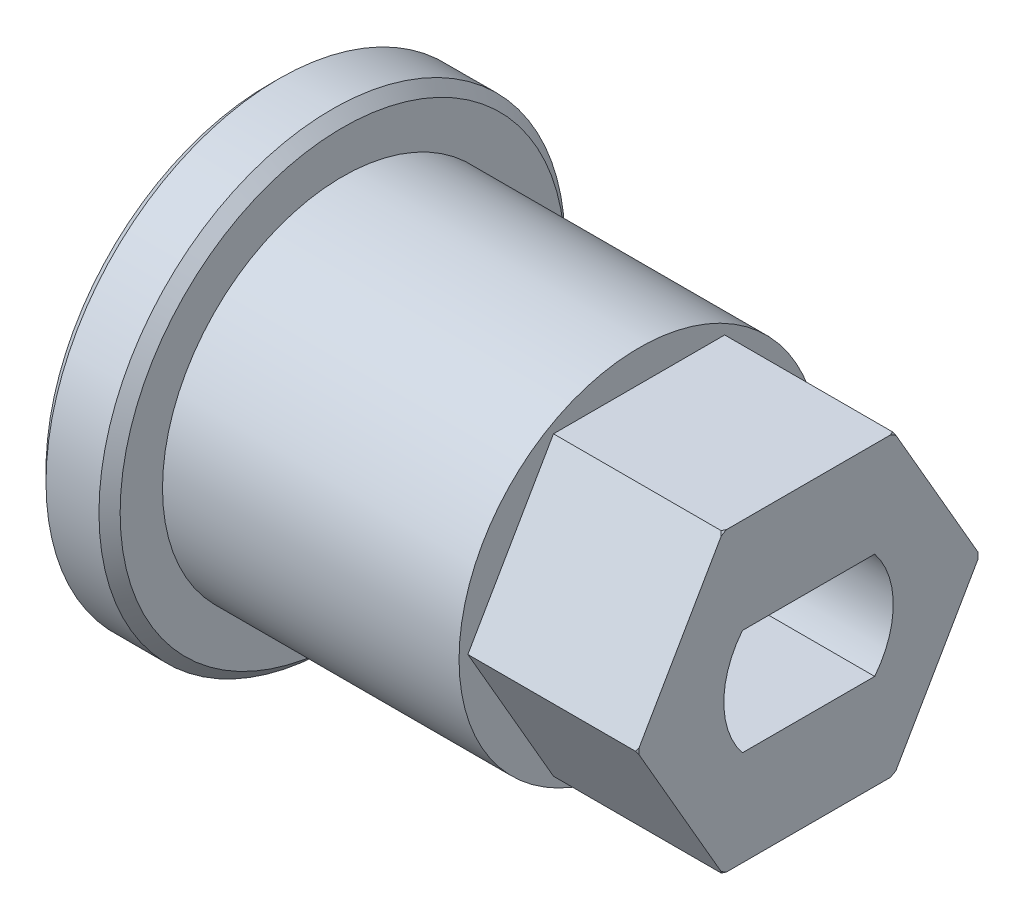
SolidWorks part; units mm, degrees
ref_plane "Plan1" through (0, 0, 0) normal (0, 0, 1) x (1, 0, 0)
ref_plane "Plan2" through (0, 0, 0) normal (0, 1, 0) x (1, 0, 0)
ref_plane "Plan3" through (0, 0, 0) normal (1, 0, 0) x (0, 0, -1)
sketch "Esquisse1" plane through (0, 0, 0) normal (0, 0, 1) x (1, 0, 0)
  line L0 (0, 0) -> (90, 0) construction
  line L1 (0, 0) -> (0, 11)
  line L2 (0, 11) -> (3.5, 11)
  line L3 (3.5, 11) -> (3.5, 8.5)
  line L4 (3.5, 8.5) -> (25.5, 8.5)
  line L5 (25.5, 8.5) -> (25.5, 0)
  line L6 (0, 0) -> (25.5, 0)
  dimension "D1" = 22
  dimension "D2" = 17
  dimension "D3" = 25.5
  dimension "D4" = 3.5
revolve "Base-Révolution" add sketch "Esquisse1" angle 360 about L0
sketch "Esquisse2" plane through (25.5, 0, 0) normal (1, 0, 0) x (0, 0, -1)
  line L0 (0, 0) -> (11.7399, 0) construction
  line L1 (-3.1225, 2.5) -> (3.1225, 2.5)
  line L2 (-3.1225, -2.5) -> (3.1225, -2.5)
  arc A0 (-3.1225, 2.5) -> (-3.1225, -2.5) centre (0, 0) ccw
  arc A1 (3.1225, -2.5) -> (3.1225, 2.5) centre (0, 0) ccw
  dimension "D1" = 8
  dimension "D2" = 5
extrude "Enlèv. mat.-Extru.1" cut sketch "Esquisse2" against normal through all
chamfer "Chanfrein1" distance 0.5 angle 45
sketch "Esquisse3" plane through (25.5, 0, 0) normal (1, 0, 0) x (0, 0, -1)
  line L0 (0, 0) -> (7.8448, 0) construction
  line L2 (8.0829, 0) -> (4.0415, 7)
  line L3 (4.0415, 7) -> (-4.0415, 7)
  line L4 (-4.0415, 7) -> (-8.0829, 0)
  line L5 (-8.0829, 0) -> (-4.0415, -7)
  line L6 (-4.0415, -7) -> (4.0415, -7)
  line L7 (4.0415, -7) -> (8.0829, 0)
  circle A1 centre (0, 0) radius 7 construction
  circle A2 centre (0, 0) radius 9.9057
  dimension "D1" = 14
extrude "Enlèv. mat.-Extru.2" cut sketch "Esquisse3" against normal blind 8
